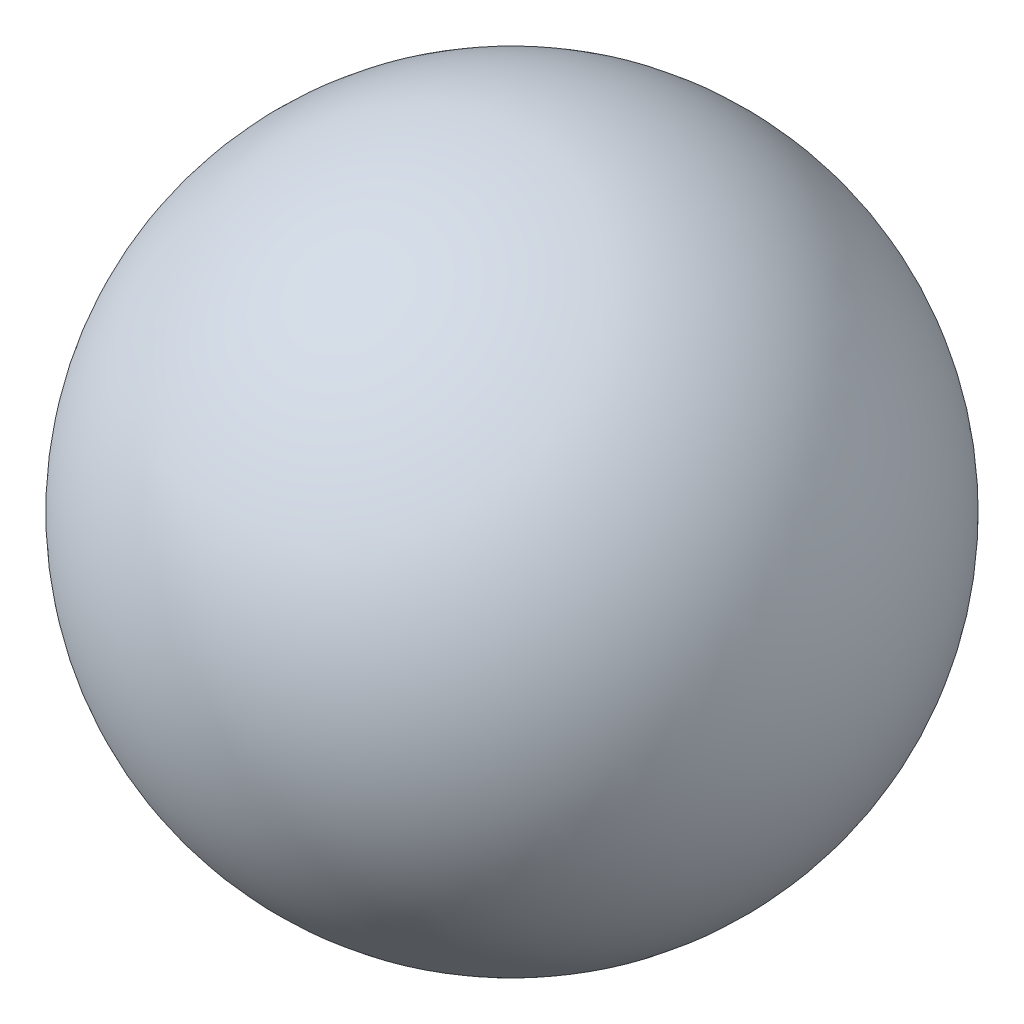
SolidWorks part; units mm, degrees
ref_plane "Front Plane" through (0, 0, 0) normal (0, 0, 1) x (1, 0, 0)
ref_plane "Top Plane" through (0, 0, 0) normal (0, 1, 0) x (1, 0, 0)
ref_plane "Right Plane" through (0, 0, 0) normal (1, 0, 0) x (0, 0, -1)
sketch "Sketch1" plane through (0, 0, 0) normal (0, 0, 1) x (1, 0, 0)
  line L0 (0, -2.5) -> (0, 2.5)
  arc A0 (0, 2.5) -> (0, -2.5) centre (0, 0) cw
  dimension "D1" = 2.5
  dimension "D2" = 5
revolve "Revolve1" add sketch "Sketch1" angle 360 about L0
